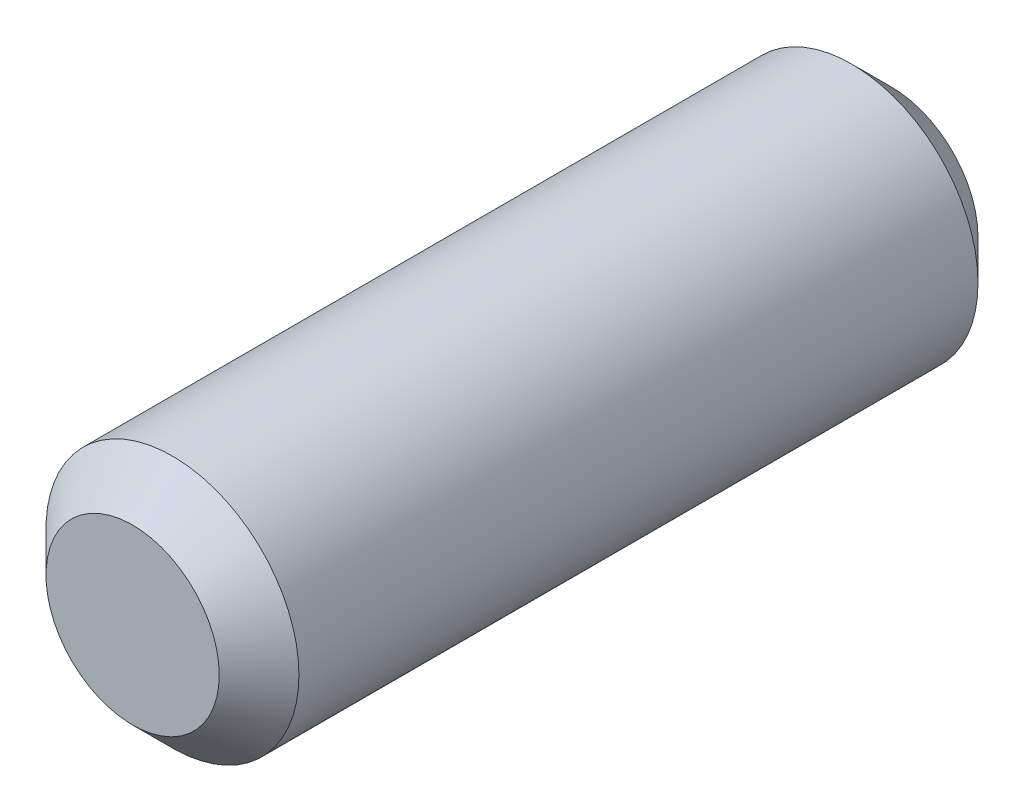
SolidWorks part; units mm, degrees
ref_plane "前视" through (0, 0, 0) normal (0, 0, 1) x (1, 0, 0)
ref_plane "上视" through (0, 0, 0) normal (0, 1, 0) x (1, 0, 0)
ref_plane "右视" through (0, 0, 0) normal (1, 0, 0) x (0, 0, -1)
sketch "草图1" plane through (0, 0, 0) normal (0, 0, 1) x (1, 0, 0)
  circle A0 centre (0, 0) radius 2
  dimension "D1" = 4
extrude "拉伸1" add sketch "草图1" along normal mid plane 12
chamfer "倒角1" distance 0.63 angle 45
